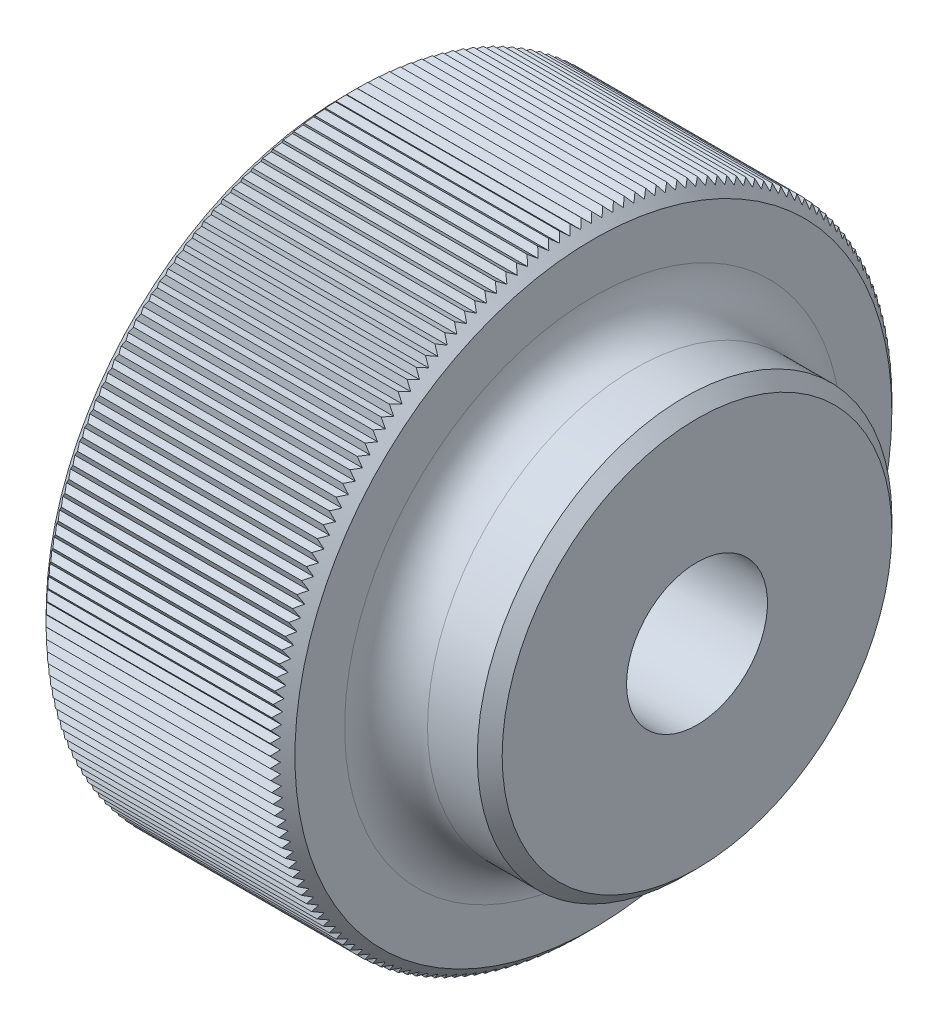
SolidWorks part; units mm, degrees
ref_plane "Front Plane" through (0, 0, 0) normal (0, 0, 1) x (1, 0, 0)
ref_plane "Top Plane" through (0, 0, 0) normal (0, 1, 0) x (1, 0, 0)
ref_plane "Right Plane" through (0, 0, 0) normal (1, 0, 0) x (0, 0, -1)
sketch "Sketch1" plane through (0, 0, 0) normal (1, 0, 0) x (0, 0, -1)
  circle A0 centre (0, 0) radius 15
  dimension "D1" = 30
extrude "Extrude1" add sketch "Sketch1" against normal blind 12
chamfer "Chamfer1" distance 0.6 angle 45 2 edges at (-12, 0, -15) (0, 0, -15)
sketch "Sketch2" plane through (0, 0, 0) normal (1, 0, 0) x (0, 0, -1)
  line L0 (0, 0) -> (0, 50000) construction
  line L1 (0, 0) -> (-872.6203, 49992.3848) construction
  line L2 (0, 15) -> (-0.2575, 14.75)
  line L3 (-0.5235, 14.9909) -> (-0.2575, 14.75)
  circle A0 centre (0, 0) radius 15 construction
  arc A1 (-0.5235, 14.9909) -> (0, 15) centre (-0.2666, 15.2746) cw
  dimension "D1" = 1
  dimension "D2" = 0.25
extrude "Extrude2" cut sketch "Sketch2" against normal through all
pattern_circular "CirPattern1" count 180 over 360 about axis through (0, 0, 0) along (1, 0, 0) of "Extrude2"
sketch "Sketch3" plane through (0, 0, 0) normal (1, 0, 0) x (0, 0, -1)
  circle A0 centre (0, 0) radius 10
  dimension "D1" = 20
extrude "Extrude3" add sketch "Sketch3" along normal blind 5
fillet "Fillet1" radius 2 1 edges at (0, 0, -10)
sketch "Sketch4" plane through (-12, 0, 0) normal (-1, 0, 0) x (0, 0, 1)
  circle A0 centre (0, 0) radius 3.4
  dimension "D1" = 6.8
extrude "Extrude4" cut sketch "Sketch4" against normal through all
sketch "Sketch5" plane through (-12, 0, 0) normal (-1, 0, 0) x (0, 0, 1)
  circle A0 centre (0, 0) radius 12
  dimension "D1" = 24
extrude "Extrude5" cut sketch "Sketch5" against normal blind 7
chamfer "Chamfer2" distance 0.6 angle 45 3 edges at (-12, 0, 12) (5, 0, -10) (-5, 0, 3.4)
sketch "Sketch6" plane through (0, 0, 0) normal (0, 0, 1) x (1, 0, 0)
  line L0 (5, -9.4) -> (5, 9.4) construction
  circle A0 centre (2, 0) radius 0.95
  dimension "D1" = 1.9
  dimension "D2" = 3
extrude "Extrude6" [suppressed] cut sketch "Sketch6" along normal through all
